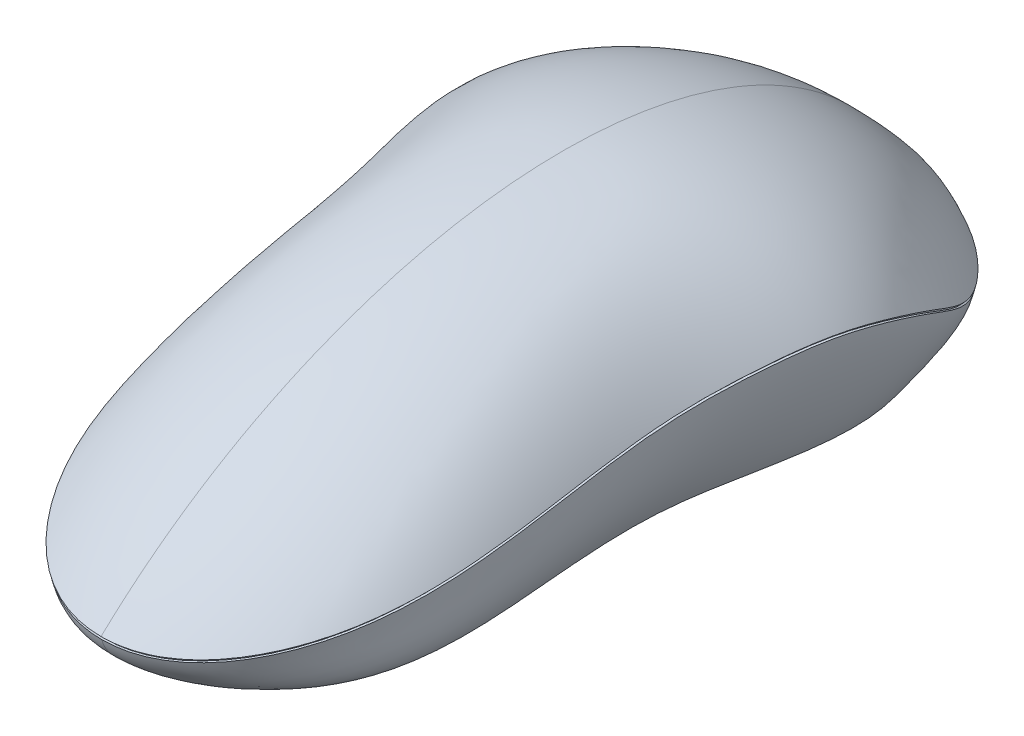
SolidWorks part; units mm, degrees
ref_plane "Front Plane" through (0, 0, 0) normal (0, 0, 1) x (1, 0, 0)
ref_plane "Top Plane" through (0, 0, 0) normal (0, 1, 0) x (1, 0, 0)
ref_plane "Right Plane" through (0, 0, 0) normal (1, 0, 0) x (0, 0, -1)
imported_body "Imported1"
sketch "Sweep Path" plane through (0, 0, 0) normal (0, 1, 0) x (1, 0, 0)
  spline S0 degree 3 number of poles 90 (0, 128.6) -> (0, -5.3) construction
  spline S1 degree 3 number of poles 90 (0, 128.6) -> (0, -5.3) construction
  spline S2 degree 3 number of poles 90 (0, 128.6) -> (0, -5.3)
  spline S3 degree 3 number of poles 90 (0, 128.6) -> (0, -5.3)
sketch "Sweep Profile" plane through (0, 0, 0) normal (1, 0, 0) x (0, 0, -1)
  line L0 (-5.3, 5.6221) -> (-5.3, 5.1221)
  line L1 (-5.3, 5.6221) -> (-4.8, 5.6221)
  line L2 (-5.3, 5.1221) -> (-4.8, 5.1221)
  line L3 (-4.8, 5.6221) -> (-4.8, 5.1221)
  line L4 (-5.3, 5.1221) -> (-5.3, 0) construction
  dimension "D1" = 0.5
sweep "Cut-Sweep1" cut profiles "Sweep Profile" path "Sweep Path"
